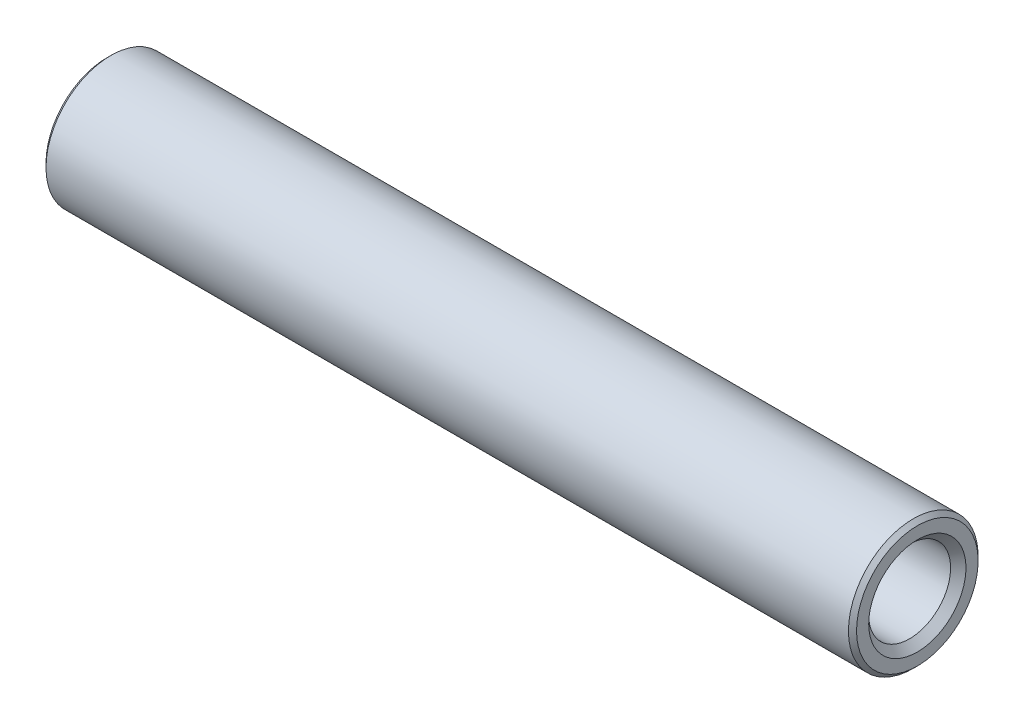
SolidWorks part; units mm, degrees
ref_plane "前视基准面" through (0, 0, 0) normal (0, 0, 1) x (1, 0, 0)
ref_plane "上视基准面" through (0, 0, 0) normal (0, 1, 0) x (1, 0, 0)
ref_plane "右视基准面" through (0, 0, 0) normal (1, 0, 0) x (0, 0, -1)
sketch "草图1" plane through (0, 0, 0) normal (0, 0, 1) x (1, 0, 0)
  line L0 (0, 7.5) -> (0, 5)
  line L1 (0, 5) -> (100, 5)
  line L2 (100, 5) -> (100, 7.5)
  line L3 (100, 7.5) -> (99.5, 8)
  line L4 (99.5, 8) -> (0.5, 8)
  line L5 (0.5, 8) -> (0, 7.5)
  line L6 (100, 0) -> (0, 0) construction
revolve "旋转1" add sketch "草图1" angle 360 about L6
sketch "草图2" plane through (0, 0, 0) normal (0, 0, 1) x (1, 0, 0)
  line L0 (0, 0) -> (0, 6)
  line L1 (0, 6) -> (0.947, 5.053)
  line L2 (0.947, 5.053) -> (27.0826, 5.053)
  line L3 (27.0826, 5.053) -> (30, 0)
  line L4 (30, 0) -> (0, 0)
  line L5 (30, 0) -> (0, 0) construction
revolve "切除-旋转1" cut sketch "草图2" angle 360 about L5
sketch "草图3" plane through (0, 0, 0) normal (0, 0, 1) x (1, 0, 0)
  line L0 (70, 0) -> (72.9174, 5.053)
  line L1 (72.9174, 5.053) -> (99.053, 5.053)
  line L2 (99.053, 5.053) -> (100, 6)
  line L3 (100, 6) -> (100, 0)
  line L4 (100, 0) -> (70, 0)
  line L5 (100, 0) -> (70, 0) construction
revolve "切除-旋转2" cut sketch "草图3" angle 360 about L5
